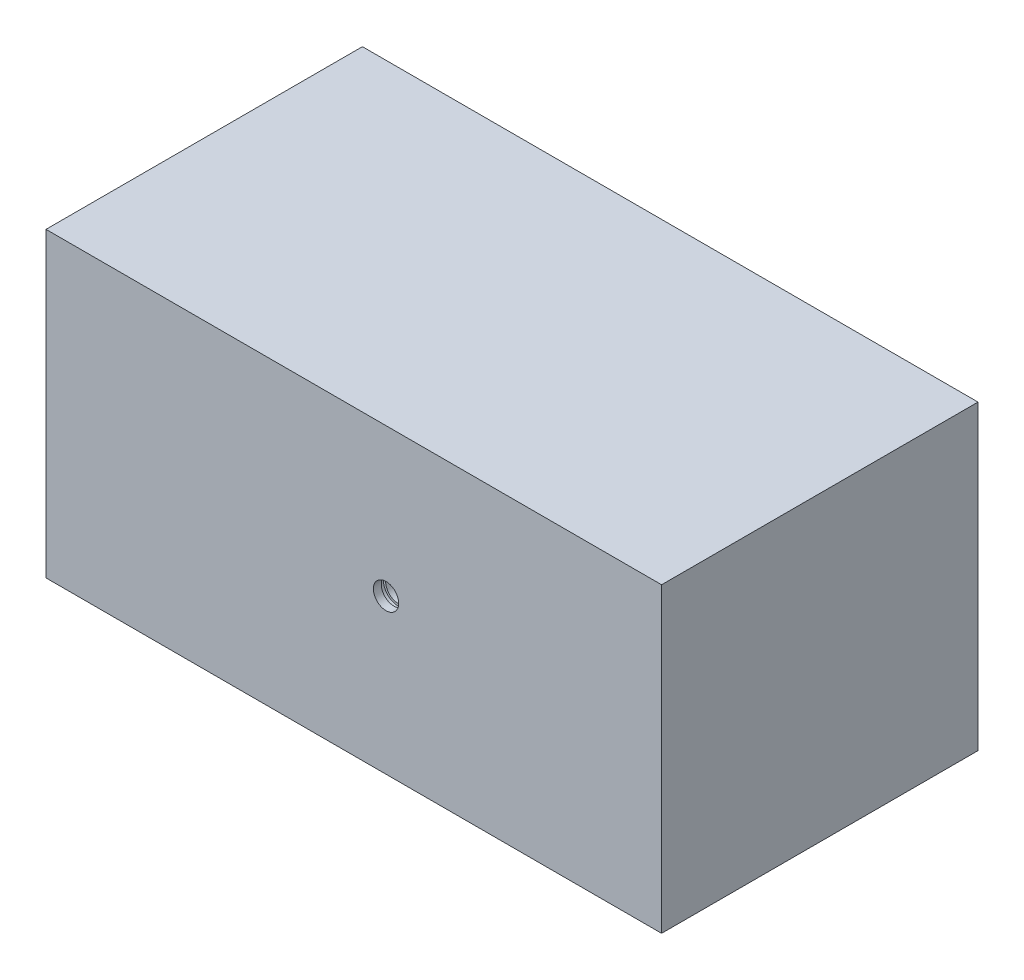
SolidWorks part; units mm, degrees
ref_plane "Ebene vorne" through (0, 0, 0) normal (0, 0, 1) x (1, 0, 0)
ref_plane "Ebene oben" through (0, 0, 0) normal (0, 1, 0) x (1, 0, 0)
ref_plane "Ebene rechts" through (0, 0, 0) normal (1, 0, 0) x (0, 0, -1)
sketch "Skizze1" plane through (0, 0, 0) normal (0, 0, 1) x (1, 0, 0)
  line L1 (0, 0) -> (97.2759, 0)
  line L2 (0, 0) -> (0, 47.7052)
  line L3 (0, 47.7052) -> (97.2759, 47.7052)
  line L4 (97.2759, 0) -> (97.2759, 47.7052)
extrude "Linear austragen1" add sketch "Skizze1" along normal blind 50
hole_wizard "Ø4.0 (4) Durchmesser Bohrung1" positions "3D-Skizze1" profile "Skizze2" hole size "Ø4.0" standard "DIN"
sketch3d "3D-Skizze1"
  point P0 (53.7287, 24.3825, 50)
sketch "Skizze2" plane through (53.7287, 24.3825, 50) normal (1, 0, 0) x (0, -1, 0)
  line L0 (0, 0) -> (0, 15.2017)
  line L1 (0, 15.2017) -> (2, 14)
  line L2 (2, 14) -> (2, 0)
  line L5 (2, 0) -> (0, 0)
  line L10 (0, 15.2017) -> (-2, 14) construction
  line L11 (0, -6.35) -> (0, 107.95) construction
  dimension "Bohrerdurchmesser" = 4
  dimension "Bohrungstiefe" = 14
  dimension "Spitzenwinkel" = 118
ref_plane "Ebene1" through (53.7287, 0, 0) normal (1, 0, 0) x (0, 0, -1)
sketch "Skizze3" plane through (53.7287, 0, 0) normal (1, 0, 0) x (0, 0, -1)
  line L1 (-48.7523, 26.7321) -> (-48.059, 26.7321)
  line L2 (-48.7523, 26.7321) -> (-48.7523, 26.0391)
  line L3 (-48.7523, 26.0391) -> (-48.059, 26.0391)
  line L4 (-48.059, 26.7321) -> (-48.059, 26.0391)
revolve "Schnitt-Rotation1" cut sketch "Skizze3" angle 360 about axis through (53.7287, 24.3825, 50) along (0, 0, 1)
